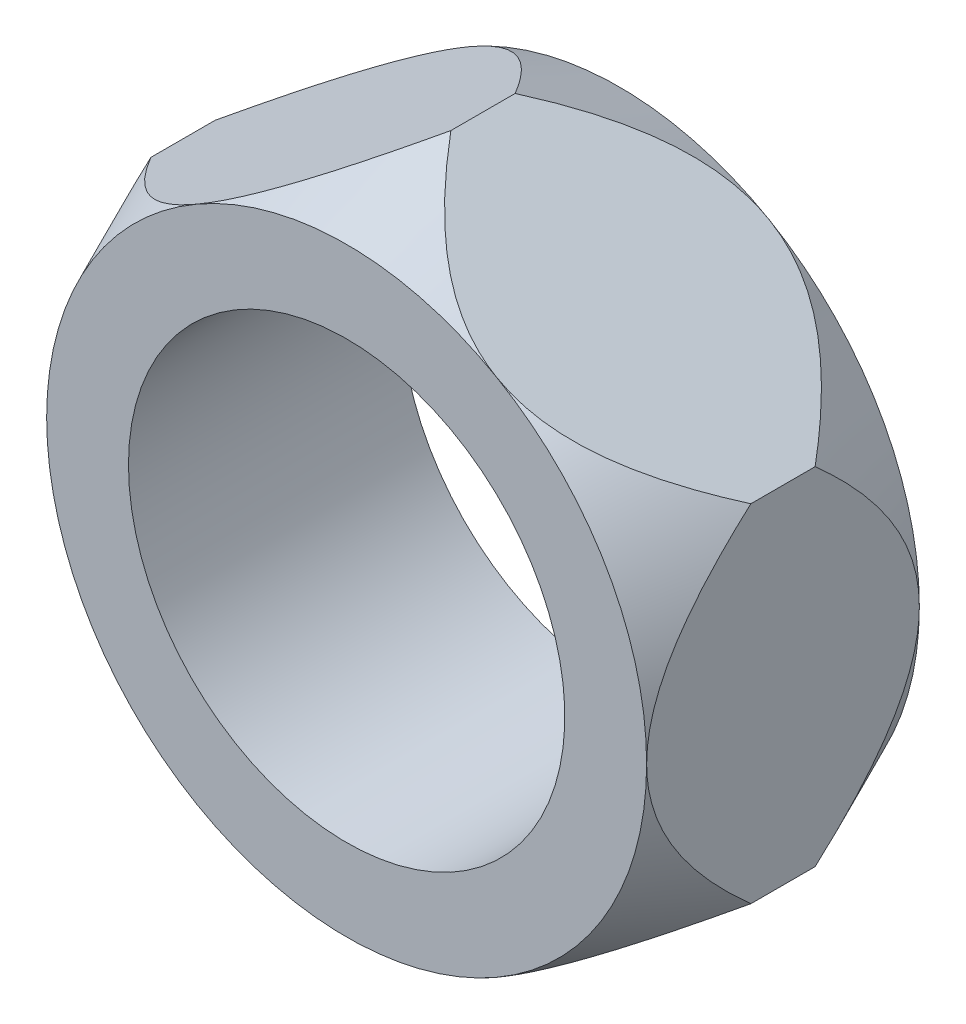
SolidWorks part; units mm, degrees
ref_plane "Front Plane" through (0, 0, 0) normal (0, 0, 1) x (1, 0, 0)
ref_plane "Top Plane" through (0, 0, 0) normal (0, 1, 0) x (1, 0, 0)
ref_plane "Right Plane" through (0, 0, 0) normal (1, 0, 0) x (0, 0, -1)
sketch "Sketch1" plane through (0, 0, 0) normal (0, 0, 1) x (1, 0, 0)
  line L1 (0, 3.1754) -> (-2.75, 1.5877)
  line L2 (-2.75, 1.5877) -> (-2.75, -1.5877)
  line L3 (-2.75, -1.5877) -> (0, -3.1754)
  line L4 (0, -3.1754) -> (2.75, -1.5877)
  line L5 (2.75, -1.5877) -> (2.75, 1.5877)
  line L6 (2.75, 1.5877) -> (0, 3.1754)
  circle A0 centre (0, 0) radius 2.75 construction
extrude "Boss-Extrude1" add sketch "Sketch1" along normal blind 2.5
sketch "Sketch2" plane through (0, 0, 0) normal (0, 0, -1) x (-1, 0, 0)
  circle A0 centre (0, 0) radius 2.75
extrude "Cut-Extrude1" cut sketch "Sketch2" against normal through all draft 24 flip side to cut
ref_plane "Plane1" through (0, 0, 1.25) normal (0, 0, 1) x (1, 0, 0)
mirror "Mirror1" about plane through (0, 0, 1.25) normal (0, 0, 1) of "Cut-Extrude1"
sketch "Sketch3" plane through (0, 0, 0) normal (0, 0, -1) x (-1, 0, 0)
  circle A0 centre (0, 0) radius 2
extrude "Cut-Extrude2" cut sketch "Sketch3" against normal blind 2.5
